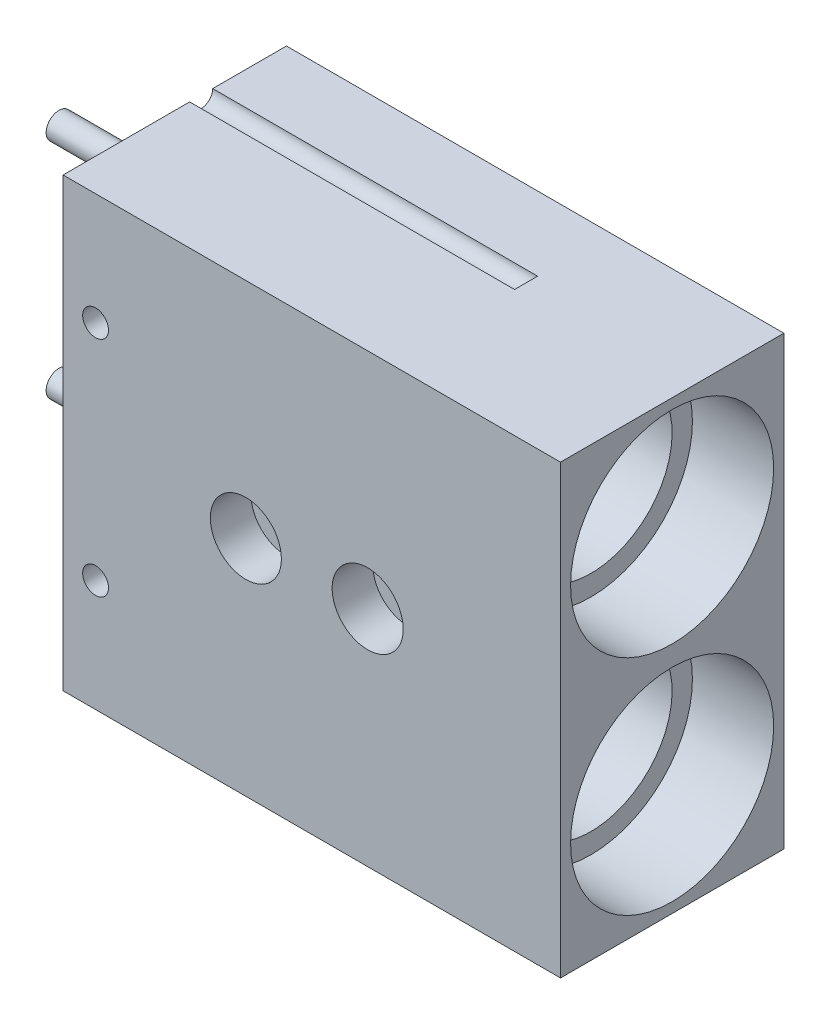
SolidWorks part; units mm, degrees
ref_plane "Front Plane" through (0, 0, 0) normal (0, 0, 1) x (1, 0, 0)
ref_plane "Top Plane" through (0, 0, 0) normal (0, 1, 0) x (1, 0, 0)
ref_plane "Right Plane" through (0, 0, 0) normal (1, 0, 0) x (0, 0, -1)
sketch "Sketch1" plane through (0, 0, 0) normal (0, 0, 1) x (1, 0, 0)
  line L1 (-22.5967, 15.4214) -> (55.1781, 15.4214)
  line L2 (-22.5967, 15.4214) -> (-22.5967, -54.4286)
  line L3 (-22.5967, -54.4286) -> (55.1781, -54.4286)
  line L4 (55.1781, 15.4214) -> (55.1781, -54.4286)
  dimension "D1" = 77.7748
  dimension "D2" = 69.85
extrude "Extrude1" add sketch "Sketch1" against normal blind 34.925
sketch "Sketch12" plane through (0, 0, 0) normal (0, 0, 1) x (1, 0, 0)
  line L0 (-25.2482, -19.5036) -> (57.5986, -19.5036) construction
  line L1 (55.1781, 15.4214) -> (-22.5967, 15.4214) construction
  dimension "D1" = 34.925
hole_wizard "#10-32 Tapped Hole1" positions "Sketch3" profile "Sketch2" tap size "#10-32" standard "Ansi Inch"
sketch "Sketch3" plane through (0, 0, 0) normal (0, 0, 1) x (1, 0, 0)
  line L0 (-22.5967, 15.4214) -> (-22.5967, -54.4286) construction
  line L2 (-25.2482, -19.5036) -> (57.5986, -19.5036) construction
  point P0 (-17.5167, -2.0538)
  dimension "D1" = 5.08
  dimension "D2" = 17.4498
sketch "Sketch2" plane through (-17.5167, -2.0538, 0) normal (1, 0, 0) x (0, -1, 0)
  line L0 (0, 0) -> (0, 13.2529)
  line L1 (0, 13.2529) -> (2.0193, 12.0396)
  line L2 (2.0193, 12.0396) -> (2.0193, 0)
  line L5 (2.0193, 0) -> (0, 0)
  line L10 (0, 13.2529) -> (-2.0193, 12.0396) construction
  line L11 (0, -6.35) -> (0, 107.95) construction
  dimension "Tap Drill Dia." = 4.0386
  dimension "Tap Drill Depth" = 12.0396
  dimension "Drill Angle" = 118
hole_wizard "#10-32 Tapped Hole2" positions "Sketch5" profile "Sketch4" tap size "#10-32" standard "Ansi Inch"
sketch "Sketch5" plane through (0, 0, 0) normal (0, 0, 1) x (1, 0, 0)
  line L0 (-22.5967, 15.4214) -> (-22.5967, -54.4286) construction
  point P0 (-17.5167, -36.9534)
  dimension "D1" = 5.08
  dimension "D2" = 34.8996
sketch "Sketch4" plane through (-17.5167, -36.9534, 0) normal (1, 0, 0) x (0, -1, 0)
  line L0 (0, 0) -> (0, 13.2529)
  line L1 (0, 13.2529) -> (2.0193, 12.0396)
  line L2 (2.0193, 12.0396) -> (2.0193, 0)
  line L5 (2.0193, 0) -> (0, 0)
  line L10 (0, 13.2529) -> (-2.0193, 12.0396) construction
  line L11 (0, -6.35) -> (0, 107.95) construction
  dimension "Tap Drill Dia." = 4.0386
  dimension "Tap Drill Depth" = 12.0396
  dimension "Drill Angle" = 118
hole_wizard "CBORE for 1/4 Socket Head Cap Screw1" positions "Sketch7" profile "Sketch6" counterbore size "1/4" standard "Ansi Inch"
sketch "Sketch7" plane through (0, 0, 0) normal (0, 0, 1) x (1, 0, 0)
  line L0 (-22.5967, 15.4214) -> (-22.5967, -54.4286) construction
  line L1 (-22.5967, -54.4286) -> (55.1781, -54.4286) construction
  point P0 (5.9783, -19.5036)
  dimension "D1" = 28.575
  dimension "D2" = 34.925
sketch "Sketch6" plane through (5.9783, -19.5036, 0) normal (1, 0, 0) x (0, -1, 0)
  line L0 (0, 0) -> (0, 34.925)
  line L1 (0, 34.925) -> (3.3782, 34.925)
  line L3 (3.3782, 34.925) -> (3.3782, 6.35)
  line L4 (3.3782, 6.35) -> (5.5562, 6.35)
  line L5 (5.5562, 6.35) -> (5.5563, 0)
  line L7 (5.5563, 0) -> (0, 0)
  line L11 (0, -6.35) -> (0, 107.95) construction
  dimension "Thru Hole Dia." = 6.7564
  dimension "Thru Hole Depth" = 34.925
  dimension "C'Bore Dia." = 11.1125
  dimension "C'Bore Depth" = 6.35
hole_wizard "CBORE for 1/4 Socket Head Cap Screw2" positions "3DSketch1" profile "Sketch8" counterbore size "1/4" standard "Ansi Inch"
sketch3d "3DSketch1"
  line L0 (-22.5967, -54.4286, 0) -> (55.1781, -54.4286, 0) construction
  line L1 (-22.5967, 15.4214, 0) -> (-22.5967, -54.4286, 0) construction
  point P0 (25.0283, -19.5036, 0)
  dimension "D1" = 34.925
  dimension "D2" = 47.625
sketch "Sketch8" plane through (25.0283, -19.5036, 0) normal (1, 0, 0) x (0, -1, 0)
  line L0 (0, 0) -> (0, 34.925)
  line L1 (0, 34.925) -> (3.3782, 34.925)
  line L3 (3.3782, 34.925) -> (3.3782, 6.35)
  line L4 (3.3782, 6.35) -> (5.5562, 6.35)
  line L5 (5.5562, 6.35) -> (5.5562, 0)
  line L7 (5.5562, 0) -> (0, 0)
  line L11 (0, -6.35) -> (0, 107.95) construction
  dimension "Thru Hole Dia." = 6.7564
  dimension "Thru Hole Depth" = 34.925
  dimension "C'Bore Dia." = 11.1125
  dimension "C'Bore Depth" = 6.35
hole_wizard "3/16 (0.1875) Diameter Hole1" positions "Sketch14" profile "Sketch13" hole size "3/16" standard "Ansi Inch"
sketch "Sketch14" plane through (0, 0, -34.925) normal (0, 0, -1) x (-1, 0, 0)
  line L0 (25.2482, -19.5036) -> (-57.5986, -19.5036) construction
  line L1 (22.5967, 15.4214) -> (22.5967, -54.4286) construction
  point P0 (-15.5033, 12.2464)
  dimension "D1" = 31.75
  dimension "D2" = 38.1
sketch "Sketch13" plane through (15.5033, 12.2464, -34.925) normal (1, 0, 0) x (0, 1, 0)
  line L0 (0, 0) -> (0, 7.7808)
  line L1 (0, 7.7808) -> (2.3812, 6.35)
  line L2 (2.3812, 6.35) -> (2.3812, 0)
  line L5 (2.3812, 0) -> (0, 0)
  line L10 (0, 7.7808) -> (-2.3812, 6.35) construction
  line L11 (0, -6.35) -> (0, 107.95) construction
  dimension "Hole Dia." = 4.7625
  dimension "Hole Depth" = 6.35
  dimension "Drill Angle" = 118
hole_wizard "3/16 (0.1875) Diameter Hole2" positions "Sketch16" profile "Sketch15" hole size "3/16" standard "Ansi Inch"
sketch "Sketch16" plane through (0, 0, -34.925) normal (0, 0, -1) x (-1, 0, 0)
  line L0 (25.2482, -19.5036) -> (-57.5986, -19.5036) construction
  line L1 (22.5967, 15.4214) -> (22.5967, -54.4286) construction
  point P0 (-15.5033, -51.2536)
  dimension "D1" = 31.75
  dimension "D2" = 38.1
sketch "Sketch15" plane through (15.5033, -51.2536, -34.925) normal (1, 0, 0) x (0, 1, 0)
  line L0 (0, 0) -> (0, 7.7808)
  line L1 (0, 7.7808) -> (2.3812, 6.35)
  line L2 (2.3812, 6.35) -> (2.3812, 0)
  line L5 (2.3812, 0) -> (0, 0)
  line L10 (0, 7.7808) -> (-2.3812, 6.35) construction
  line L11 (0, -6.35) -> (0, 107.95) construction
  dimension "Hole Dia." = 4.7625
  dimension "Hole Depth" = 6.35
  dimension "Drill Angle" = 118
sketch "Sketch17" plane through (-22.5967, 0, 0) normal (-1, 0, 0) x (0, 0, 1)
  line L0 (-34.925, 15.4214) -> (0, 15.4214) construction
  line L1 (-34.925, 15.4214) -> (-34.925, -54.4286) construction
  circle A0 centre (-21.59, 15.4214) radius 1.8034
  dimension "D1" = 3.6068
  dimension "D2" = 13.335
extrude "Cut-Extrude1" cut sketch "Sketch17" against normal blind 50.8
sketch "Sketch18" plane through (-22.5967, 0, 0) normal (-1, 0, 0) x (0, 0, 1)
  line L0 (-34.925, -54.4286) -> (0, -54.4286) construction
  circle A0 centre (-21.59, -54.4286) radius 1.8034
  dimension "D1" = 3.6068
  dimension "D2" = 13.335
extrude "Cut-Extrude2" cut sketch "Sketch18" against normal blind 50.8
sketch "Sketch19" plane through (-22.5967, 0, 0) normal (-1, 0, 0) x (0, 0, 1)
  line L0 (-34.925, -54.4286) -> (-23.3934, -54.4286) construction
  line L1 (-34.925, 15.4214) -> (-23.3934, 15.4214) construction
  line L2 (0, 15.4214) -> (0, -54.4286) construction
  circle A0 centre (-23.876, -2.0411) radius 2.0193
  circle A1 centre (-23.876, -36.9661) radius 2.0193
  dimension "D1" = 4.0386
  dimension "D2" = 4.0386
  dimension "D3" = 17.4625
  dimension "D4" = 17.4625
  dimension "D5" = 23.876
  dimension "D6" = 23.876
extrude "Extrude2" add sketch "Sketch19" along normal blind 24.511
sketch "Sketch20" plane through (55.1781, 0, 0) normal (1, 0, 0) x (0, 0, -1)
  line L0 (34.925, -54.4286) -> (34.925, 15.4214) construction
  line L1 (-0.9008, -19.5036) -> (36.6728, -19.5036) construction
  line L2 (34.925, 15.4214) -> (0, 15.4214) construction
  circle A0 centre (17.4498, -2.0284) radius 12.7
  circle A1 centre (17.4498, -36.9788) radius 12.7
  dimension "D1" = 25.4
  dimension "D2" = 25.4
  dimension "D3" = 17.4752
  dimension "D4" = 17.4752
  dimension "D5" = 34.925
  dimension "D6" = 17.4752
  dimension "D7" = 17.4752
extrude "Cut-Extrude3" cut sketch "Sketch20" against normal blind 63.5
sketch "Sketch21" plane through (55.1781, 0, 0) normal (1, 0, 0) x (0, 0, -1)
  line L0 (34.925, -54.4286) -> (34.925, 15.4214) construction
  line L1 (34.925, -54.4286) -> (0, -54.4286) construction
  line L2 (34.925, 15.4214) -> (0, 15.4214) construction
  circle A0 centre (17.4498, -2.0538) radius 15.875
  circle A1 centre (17.4498, -36.9534) radius 15.875
  dimension "D5" = 31.75
  dimension "D6" = 31.75
  dimension "D1" = 17.4752
  dimension "D2" = 17.4752
  dimension "D3" = 17.4752
  dimension "D4" = 17.4752
extrude "Cut-Extrude4" cut sketch "Sketch21" against normal blind 12.7
sketch "Sketch23"
